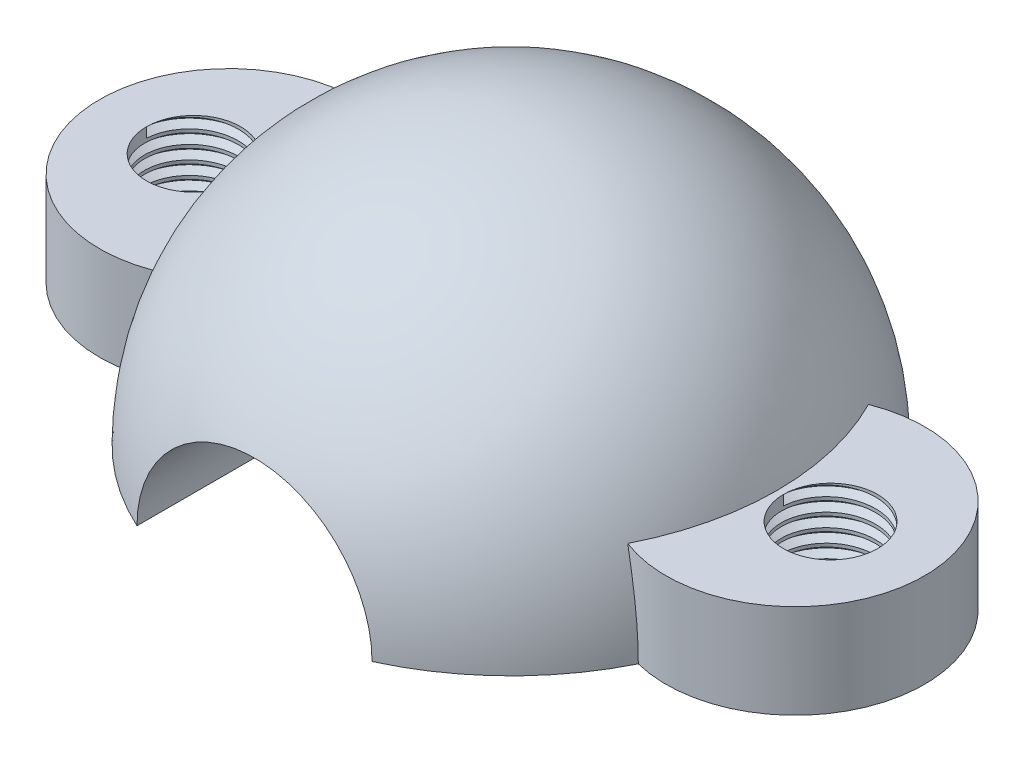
SolidWorks part; units mm, degrees
ref_plane "Front Plane" through (0, 0, 0) normal (0, 0, 1) x (1, 0, 0)
ref_plane "Bottom Plane" through (0, 0, 0) normal (0, 1, 0) x (1, 0, 0)
ref_plane "Right Plane" through (0, 0, 0) normal (1, 0, 0) x (0, 0, -1)
sketch "Sketch2" plane through (0, 0, 0) normal (0, 0, 1) x (1, 0, 0)
  line L0 (0, 19.05) -> (0, -19.05)
  arc A0 (0, 19.05) -> (0, -19.05) centre (0, 0) cw
  dimension "D1" = 19.05
  dimension "D2" = 38.1
revolve "Revolve1" add sketch "Sketch2" angle 360 about L0
sketch "Sketch3" plane through (0, 0, 0) normal (0, 0, 1) x (1, 0, 0)
  circle A0 centre (0, 0) radius 7.9375
  dimension "D1" = 15.875
extrude "Cut-Extrude1" cut sketch "Sketch3" against normal mid plane 38.1
sketch "Sketch4" plane through (0, 0, 0) normal (0, 0, 1) x (1, 0, 0)
  line L1 (-19.05, 0) -> (19.1115, 0)
  line L2 (-19.05, 0) -> (-19.05, -19.2599)
  line L3 (-19.05, -19.2599) -> (19.1115, -19.2599)
  line L4 (19.1115, 0) -> (19.1115, -19.2599)
  line L5 (-19.05, 0) -> (19.1115, -19.2599) construction
  line L6 (-19.05, -19.2599) -> (19.1115, 0) construction
  circle A0 centre (0, 0) radius 19.05 construction
  point P4 (0.0307, -9.63)
  dimension "D1" = 0.0307
  dimension "D2" = 9.63
extrude "Cut-Extrude2" cut sketch "Sketch4" along normal mid plane 38.1
sketch "Sketch5" plane through (0, 0, 0) normal (0, 1, 0) x (1, 0, 0)
  circle A0 centre (-19.05, 0) radius 8.7312
  arc A1 (-7.9375, 17.3176) -> (-7.9375, -17.3176) centre (0, 0) ccw construction
  circle A2 centre (19.2001, 0) radius 8.7313
  dimension "D1" = 17.4625
  dimension "D2" = 17.4625
  dimension "D3" = 19.2001
extrude "Boss-Extrude1" add sketch "Sketch5" along normal blind 6.35
sketch "Sketch6" plane through (0, 0, 0) normal (0, 1, 0) x (1, 0, 0)
  line L0 (-27.7812, 0) -> (-21.4312, 0) construction
  line L1 (27.9313, 0) -> (21.5813, 0) construction
  line L2 (19.2001, 0) -> (23.9626, 0)
  line L3 (19.2001, 0) -> (19.2001, -8.7312)
  line L4 (19.2001, -8.7312) -> (23.9626, -8.7312)
  line L5 (23.9626, -8.7312) -> (23.9626, 0)
  arc A0 (-17.0491, 8.4989) -> (-17.0491, -8.4989) centre (-19.05, 0) ccw construction
  arc A2 (17.0653, -8.4663) -> (17.0653, 8.4663) centre (19.2001, 0) ccw construction
  circle A3 centre (-21.4312, 0) radius 3.175
  circle A4 centre (21.5813, 0) radius 3.175
  point P16 (21.5813, 0)
  dimension "D3" = 6.35
  dimension "D4" = 6.35
  dimension "D1" = 6.35
  dimension "D2" = 6.35
  dimension "D5" = 4.7625
extrude "Cut-Extrude3" cut sketch "Sketch6" along normal blind 10.16 contours A3 | A4
thread "Thread1" pitch 0.9071 start angle 0, offset 0, length 6.35, pitch 0.9071, diameter 6.35
ref_plane "Plane1" through (-24.6062, 6.35, 0) normal (0, 0, 1) x (-1, 0, 0)
sketch "Thread Profile1" plane through (-24.6062, 6.35, 0) normal (0, 0, 1) x (-1, 0, 0)
  line L0 (0, 0) -> (0, 0.9071) construction
  line L1 (0, 0) -> (0.491, 0.2835)
  line L2 (0.491, 0.2835) -> (0.491, 0.3969)
  line L3 (0.491, 0.3969) -> (0, 0.6804)
  line L4 (0.491, 0.3402) -> (0, 0.3402) construction
  line L11 (0, 0) -> (0, 0.6804)
  point P2 (0, 0)
  dimension "Pitch" = 0.9071
  dimension "Profile_Angle" = 60
  dimension "Profile_Land" = 0.1134
  dimension "Profile_Height" = 0.491
thread "Thread2" pitch 0.9071 start angle 0, offset 0, length 6.35, pitch 0.9071, diameter 6.35
ref_plane "Plane2" through (18.4063, 6.35, 0) normal (0, 0, 1) x (-1, 0, 0)
sketch "Thread Profile2" plane through (18.4063, 6.35, 0) normal (0, 0, 1) x (-1, 0, 0)
  line L0 (0, 0) -> (0, 0.9071) construction
  line L1 (0, 0) -> (0.491, 0.2835)
  line L2 (0.491, 0.2835) -> (0.491, 0.3969)
  line L3 (0.491, 0.3969) -> (0, 0.6804)
  line L4 (0.491, 0.3402) -> (0, 0.3402) construction
  line L11 (0, 0) -> (0, 0.6804)
  point P2 (0, 0)
  dimension "Pitch" = 0.9071
  dimension "Profile_Angle" = 60
  dimension "Profile_Land" = 0.1134
  dimension "Profile_Height" = 0.491
